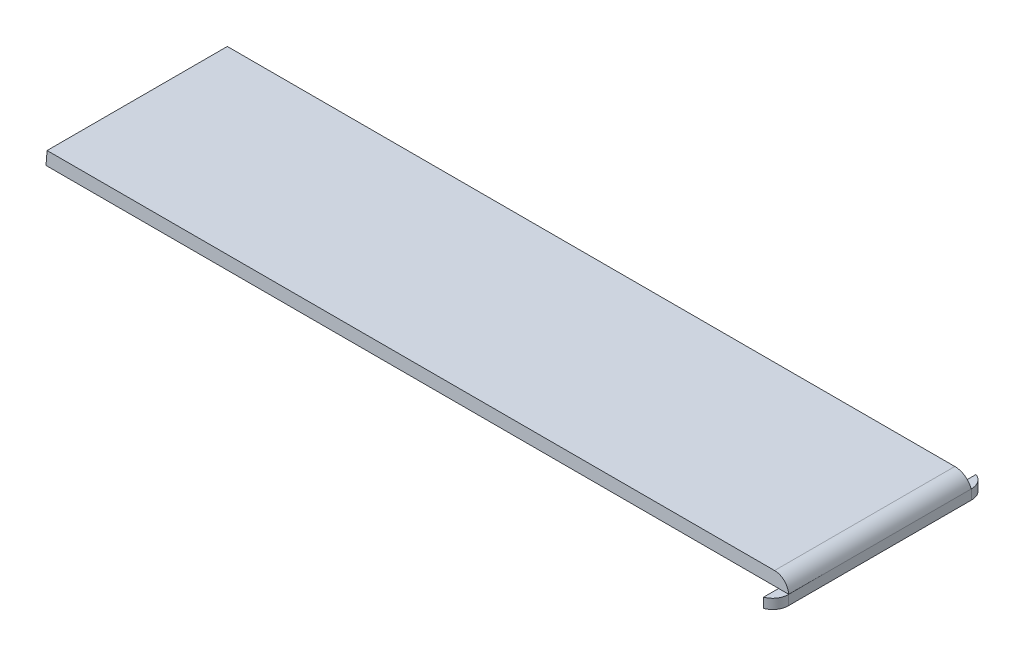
SolidWorks part; units mm, degrees
ref_plane "Front" through (0, 0, 0) normal (0, 0, 1) x (1, 0, 0)
ref_plane "Top" through (0, 0, 0) normal (0, 1, 0) x (1, 0, 0)
ref_plane "Right" through (0, 0, 0) normal (1, 0, 0) x (0, 0, -1)
sketch "Sketch2" plane through (0, 0, 0) normal (0, 1, 0) x (1, 0, 0)
  line L0 (-121.412, 0) -> (-1.651, 0) construction
  line L1 (-121.412, 0) -> (0, 0)
  line L3 (-121.412, 29.8196) -> (-1.651, 29.8196) construction
  line L4 (-121.412, 29.8196) -> (0, 29.8196)
  line L6 (-121.412, 29.8196) -> (-121.412, 0)
  line L7 (0, 0) -> (0, 29.8196)
  line L8 (0, -50) -> (0, 50) construction
  dimension "D1" = 121.412
extrude "Base-Extrude" add sketch "Sketch2" along normal blind 2.032
draft "Draft1" type of draft neutral plane draft angle 5 neutral plane "Top" faces to draft 2 parameters "D1"=5
fillet "Fillet3" radius 2.54
sketch "Sketch3" plane through (0, 0, 0) normal (0, -1, 0) x (1, 0, 0)
  line L5 (0, 0) -> (0, -29.8196) construction
  line L10 (0, 0.0762) -> (0, -29.8958)
  line L11 (-1.651, -32.2751) -> (-1.651, 2.4556)
  arc A2 (-1.651, -32.2751) -> (0, -29.8958) centre (-2.54, -29.8958) ccw
  arc A4 (0, 0.0762) -> (-1.651, 2.4556) centre (-2.54, 0.0762) ccw
  point P5 (0, -14.9098)
  point P6 (0, -14.9098)
  dimension "D2" = 2.54
  dimension "D1" = 34.7307
  dimension "D3" = 1.651
extrude "Boss-Extrude1" add sketch "Sketch3" along normal blind 1.6002
sketch "Sketch4" plane through (0, 0, 0) normal (0, -1, 0) x (1, 0, 0)
  line L0 (-120.3447, -18.4658) -> (-121.8687, -18.4658)
  line L1 (-119.0747, -17.1958) -> (-119.0747, -12.6238)
  line L2 (-121.8687, -11.3538) -> (-120.3447, -11.3538)
  line L3 (-123.1387, -12.6238) -> (-123.1387, -17.1958)
  line L5 (-123.1387, -18.7198) -> (-121.412, -18.7198) construction
  line L6 (-123.1387, -11.0998) -> (-121.412, -11.0998) construction
  line L8 (-121.412, -29.8196) -> (-121.412, 0) construction
  arc A0 (-120.3447, -11.3538) -> (-119.0747, -12.6238) centre (-120.3447, -12.6238) cw
  arc A1 (-119.0747, -17.1958) -> (-120.3447, -18.4658) centre (-120.3447, -17.1958) cw
  arc A2 (-123.1387, -17.1958) -> (-121.8687, -18.4658) centre (-121.8687, -17.1958) ccw
  arc A3 (-123.1387, -12.6238) -> (-121.8687, -11.3538) centre (-121.8687, -12.6238) cw
  dimension "D4" = 1.27
  dimension "D1" = 0.254
  dimension "D2" = 0.254
  dimension "D3" = 4.064
  dimension "D5" = 1.7267
extrude "Boss-Extrude2" add sketch "Sketch4" along normal blind 1.905
sketch "Sketch5" plane through (-217.9276, 2.032, 0) normal (0, -1, 0) x (1, 0, 0)
  line L0 (105.6596, -19.9898) -> (98.0396, -19.9898)
  line L1 (96.5156, -29.6418) -> (96.5156, -0.1778) construction
  line L2 (98.0396, -9.8298) -> (105.6596, -9.8298)
  line L3 (98.0396, -9.8298) -> (98.0396, -19.9898)
  line L4 (105.6596, -9.8298) -> (110.7396, -14.9098)
  line L5 (110.7396, -14.9098) -> (105.6596, -19.9898)
  point P5 (96.5156, -14.9098)
  dimension "D1" = 10.16
  dimension "D2" = 7.62
  dimension "D3" = 12.7
  dimension "D4" = 1.524
extrude "Cut-Extrude3" cut sketch "Sketch5" along normal blind 0.381 draft 3
